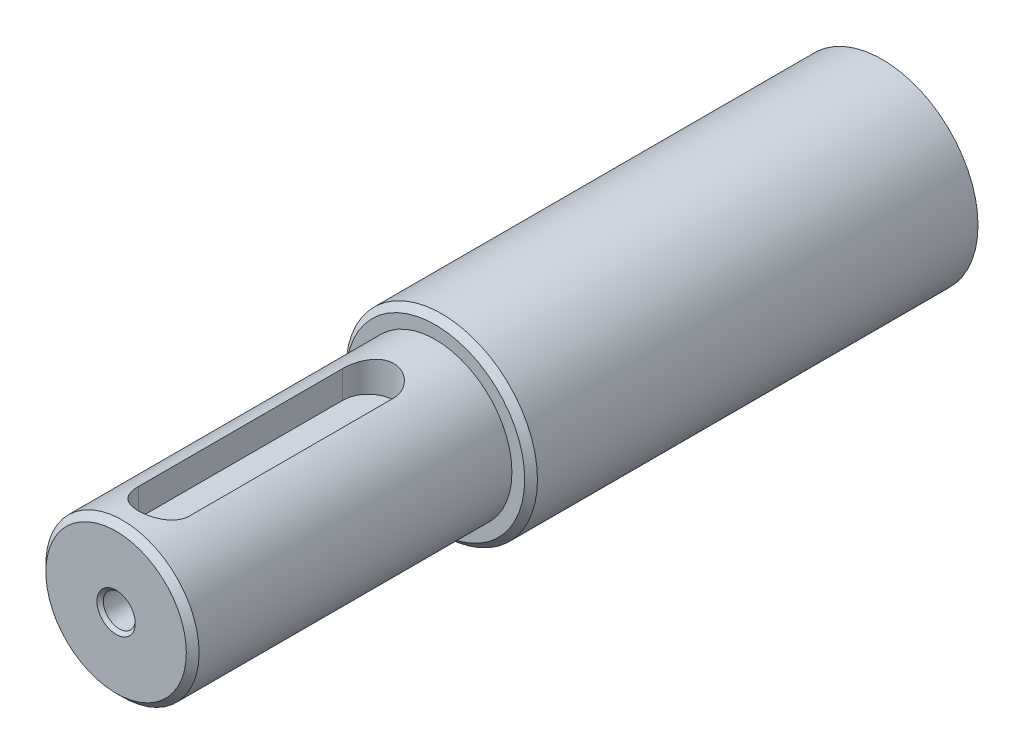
SolidWorks part; units mm, degrees
ref_plane "Plan de face" through (0, 0, 0) normal (0, 0, 1) x (1, 0, 0)
ref_plane "Plan de dessus" through (0, 0, 0) normal (0, 1, 0) x (1, 0, 0)
ref_plane "Plan de droite" through (0, 0, 0) normal (1, 0, 0) x (0, 0, -1)
sketch "Esquisse1" plane through (0, 0, 0) normal (0, 0, 1) x (1, 0, 0)
  circle A0 centre (0, 0) radius 15
  dimension "D1" = 30
extrude "Extrusion1" add sketch "Esquisse1" along normal blind 70
sketch "Esquisse2" plane through (0, 0, 70) normal (0, 0, 1) x (1, 0, 0)
  circle A0 centre (0, 0) radius 12
  dimension "D1" = 24
extrude "Extrusion2" add sketch "Esquisse2" along normal blind 50
chamfer "Chanfrein1" distance 1 angle 45 2 edges at (15, 0, 70) (12, 0, 120)
ref_plane "Plan1" through (0, 7, 0) normal (0, 1, 0) x (-1, 0, 0)
sketch "Esquisse3" plane through (0, 7, 0) normal (0, 1, 0) x (-1, 0, 0)
  line L0 (0, 112.5) -> (0, 120) construction
  line L1 (11, 120) -> (-11, 120) construction
  line L2 (4, 112.5) -> (4, 80.5)
  line L3 (-4, 80.5) -> (-4, 112.5)
  arc A0 (4, 112.5) -> (-4, 112.5) centre (0, 112.5) ccw
  arc A1 (-4, 80.5) -> (4, 80.5) centre (0, 80.5) ccw
  dimension "D1" = 8
  dimension "D2" = 32
  dimension "D3" = 7.5
extrude "Enlèv. mat.-Extru.1" cut sketch "Esquisse3" along normal through all
hole_wizard "Trou taraudé M61" positions "Esquisse5" profile "Esquisse4" tap size "M6" standard "ISO"
sketch "Esquisse5" plane through (0, 0, 120) normal (0, 0, 1) x (1, 0, 0)
  point P0 (0, 0)
sketch "Esquisse4" plane through (0, 0, 120) normal (1, 0, 0) x (0, -1, 0)
  line L0 (0, 0) -> (0, 18.5022)
  line L1 (0, 18.5022) -> (2.5, 17)
  line L2 (2.5, 17) -> (2.5, 0)
  line L5 (2.5, 0) -> (0, 0)
  line L10 (0, 18.5022) -> (-2.5, 17) construction
  line L11 (0, -6.35) -> (0, 107.95) construction
  dimension "Diamètre du trou pour taraudage" = 5
  dimension "Profondeur du trou pour taraudage" = 17
  dimension "Angle de pointe" = 118
chamfer "Chanfrein2" distance 0.5 angle 45 1 edges at (2.5, 0, 120)
